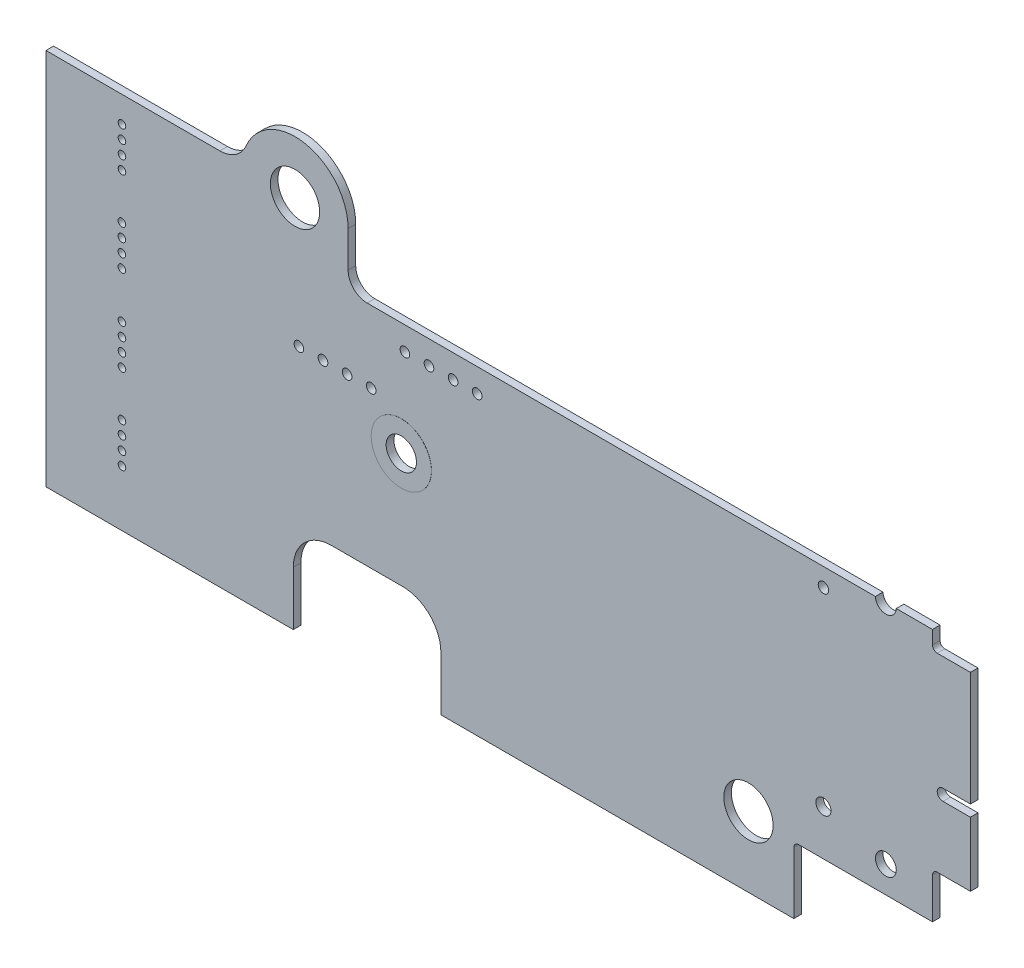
SolidWorks part; units mm, degrees
ref_plane "Front Plane" through (0, 0, 0) normal (0, 0, 1) x (1, 0, 0)
ref_plane "Top Plane" through (0, 0, 0) normal (0, 1, 0) x (1, 0, 0)
ref_plane "Right Plane" through (0, 0, 0) normal (1, 0, 0) x (0, 0, -1)
sketch "BOARD_GEOMETRY" plane through (0, 0, 0) normal (0, 0, 1) x (1, 0, 0)
  line L0 (0, 39.85) -> (0, 0)
  line L1 (0, 0) -> (26.08, 0)
  line L2 (26.08, 0) -> (26.08, 5.7)
  line L3 (30.08, 9.7) -> (37.64, 9.7)
  line L4 (41.64, 5.7) -> (41.64, 0)
  line L5 (41.64, 0) -> (78.86, 0)
  line L6 (78.86, 0) -> (78.86, 6.51)
  line L7 (79.36, 7.01) -> (93.48, 7.01)
  line L8 (93.48, 7.01) -> (93.48, 11.3)
  line L9 (93.98, 11.8) -> (97.48, 11.8)
  line L10 (97.48, 11.8) -> (97.48, 18.57)
  line L11 (97.48, 18.57) -> (94.58, 18.57)
  line L12 (94.58, 19.77) -> (97.48, 19.77)
  line L13 (97.48, 19.77) -> (97.48, 31.8)
  line L14 (97.48, 31.8) -> (93.98, 31.8)
  line L15 (93.48, 32.3) -> (93.48, 33.72)
  line L16 (93.48, 33.72) -> (89.66, 33.72)
  line L17 (87.46, 33.72) -> (33.86, 33.72)
  line L18 (31.86, 35.72) -> (31.86, 39.52)
  line L19 (18.33, 39.85) -> (0, 39.85)
  arc A0 (26.08, 5.7) -> (30.08, 9.7) centre (30.08, 5.7) cw
  arc A1 (37.64, 9.7) -> (41.64, 5.7) centre (37.64, 5.7) cw
  arc A2 (78.86, 6.51) -> (79.36, 7.01) centre (79.36, 6.51) cw
  arc A3 (93.48, 11.3) -> (93.98, 11.8) centre (93.98, 11.3) cw
  arc A4 (94.58, 18.57) -> (94.58, 19.77) centre (94.58, 19.17) cw
  arc A5 (93.98, 31.8) -> (93.48, 32.3) centre (93.98, 32.3) cw
  arc A6 (89.66, 33.72) -> (87.46, 33.72) centre (88.56, 33.76) cw
  arc A7 (33.86, 33.72) -> (31.86, 35.72) centre (33.86, 35.72) cw
  arc A8 (31.86, 39.52) -> (21.1, 41.69) centre (26.2611, 39.5198) ccw
  arc A9 (21.1, 41.69) -> (18.33, 39.85) centre (18.3323, 42.8515) cw
extrude "Board" add sketch "BOARD_GEOMETRY" along normal blind 0.8
ref_plane "BOTH" through (0, 0, 0.4) normal (0, 0, 1) x (1, 0, 0)
sketch "ROUTE_OUTLINE_ALL_ 0" plane through (0, 0, 0.4) normal (0, 0, 1) x (1, 0, 0)
  line L0 (96.88, 20.37) -> (96.88, 31.2)
  line L1 (96.88, 31.2) -> (93.98, 31.2)
  line L2 (92.88, 32.3) -> (92.88, 33.12)
  line L3 (92.88, 33.12) -> (90.1357, 33.12)
  line L4 (86.9843, 33.12) -> (33.86, 33.12)
  line L5 (31.26, 35.72) -> (31.26, 39.52)
  line L6 (18.3298, 39.25) -> (0.6, 39.25)
  line L7 (0.6, 39.25) -> (0.6, 0.6)
  line L8 (0.6, 0.6) -> (25.48, 0.6)
  line L9 (25.48, 0.6) -> (25.48, 5.7)
  line L10 (30.08, 10.3) -> (37.64, 10.3)
  line L11 (42.24, 5.7) -> (42.24, 0.6)
  line L12 (42.24, 0.6) -> (78.26, 0.6)
  line L13 (78.26, 0.6) -> (78.26, 6.51)
  line L14 (79.36, 7.61) -> (92.88, 7.61)
  line L15 (92.88, 7.61) -> (92.88, 11.3)
  line L16 (93.98, 12.4) -> (96.88, 12.4)
  line L17 (96.88, 12.4) -> (96.88, 17.97)
  line L18 (96.88, 17.97) -> (94.58, 17.97)
  line L19 (94.58, 20.37) -> (96.88, 20.37)
  arc A0 (93.98, 31.2) -> (92.88, 32.3) centre (93.98, 32.3) cw
  arc A1 (90.1357, 33.12) -> (86.9843, 33.12) centre (88.56, 33.76) cw
  arc A2 (33.86, 33.12) -> (31.26, 35.72) centre (33.86, 35.72) cw
  arc A3 (31.26, 39.52) -> (21.6532, 41.4576) centre (26.2611, 39.5198) ccw
  arc A4 (21.6532, 41.4576) -> (18.3298, 39.25) centre (18.3323, 42.8515) cw
  arc A5 (25.48, 5.7) -> (30.08, 10.3) centre (30.08, 5.7) cw
  arc A6 (37.64, 10.3) -> (42.24, 5.7) centre (37.64, 5.7) cw
  arc A7 (78.26, 6.51) -> (79.36, 7.61) centre (79.36, 6.51) cw
  arc A8 (92.88, 11.3) -> (93.98, 12.4) centre (93.98, 11.3) cw
  arc A9 (94.58, 17.97) -> (94.58, 20.37) centre (94.58, 19.17) cw
sketch "DRILLED_HOLES_PTH" plane through (0, 0, 0.8) normal (0, 0, 1) x (1, 0, 0)
  circle A0 centre (37.476, 21.793) radius 1.6
  circle A1 centre (8.011, 10.1094) radius 0.4
  circle A2 centre (8.011, 8.7094) radius 0.4
  circle A3 centre (8.011, 7.3094) radius 0.4
  circle A4 centre (8.011, 5.9094) radius 0.4
  circle A5 centre (8.001, 28.135) radius 0.4
  circle A6 centre (8.001, 26.735) radius 0.4
  circle A7 centre (8.001, 25.335) radius 0.4
  circle A8 centre (8.001, 23.935) radius 0.4
  circle A9 centre (8.011, 19.0924) radius 0.4
  circle A10 centre (8.011, 17.6924) radius 0.4
  circle A11 centre (8.011, 16.2924) radius 0.4
  circle A12 centre (8.011, 14.8924) radius 0.4
  circle A13 centre (8.011, 37.1094) radius 0.4
  circle A14 centre (8.011, 35.7094) radius 0.4
  circle A15 centre (8.011, 34.3094) radius 0.4
  circle A16 centre (8.011, 32.9094) radius 0.4
  circle A17 centre (26.67, 26.162) radius 0.508
  circle A18 centre (29.21, 26.162) radius 0.508
  circle A19 centre (31.75, 26.162) radius 0.508
  circle A20 centre (34.29, 26.162) radius 0.508
  circle A21 centre (40.386, 31.242) radius 0.508
  circle A22 centre (42.926, 31.242) radius 0.508
  circle A23 centre (45.466, 31.242) radius 0.508
  circle A24 centre (37.846, 31.242) radius 0.508
extrude "Plated_Drill_Holes" cut sketch "DRILLED_HOLES_PTH" against normal blind 0.8
sketch "DRILLED_HOLES_NPTH" plane through (0, 0, 0.8) normal (0, 0, 1) x (1, 0, 0)
  circle A0 centre (74.074, 7.405) radius 2.6
  circle A1 centre (26.259, 39.52) radius 2.6
  circle A2 centre (88.562, 9.831) radius 1.1
  circle A3 centre (81.981, 31.793) radius 0.55
  circle A4 centre (81.981, 11.793) radius 0.8
extrude "Non_Plated_Drill_Holes" cut sketch "DRILLED_HOLES_NPTH" against normal through all
sketch "PlaceKeepout_BOTTOM__0" plane through (0, 0, 0) normal (0, 0, 1) x (1, 0, 0)
  line L0 (11.176, 12.7) -> (14.351, 12.7)
  line L1 (14.351, 12.7) -> (14.351, 37.592)
  line L2 (14.351, 37.592) -> (11.176, 37.592)
  line L3 (11.176, 37.592) -> (11.176, 12.7)
sketch "PlaceKeepout_BOTTOM_2_1" plane through (0, 0, 0) normal (0, 0, 1) x (1, 0, 0)
  line L0 (30.3732, 32.4652) -> (30.3732, 21.3739)
  line L1 (30.3732, 21.3739) -> (47.4627, 11.1512)
  line L2 (47.4627, 11.1512) -> (83.4986, 11.1512)
  line L3 (83.4986, 11.1512) -> (83.4986, 32.4652)
  line L4 (83.4986, 32.4652) -> (30.3732, 32.4652)
sketch "PlaceKeepout_TOP_5_2" plane through (0, 0, 0.8) normal (0, 0, 1) x (1, 0, 0)
  line L0 (22.3852, 48.2184) -> (22.3852, 0.5232)
  line L1 (22.3852, 0.5232) -> (30.67, 0.56)
  line L2 (30.67, 0.56) -> (30.43, 4.79)
  line L3 (30.43, 4.79) -> (41.6367, 4.8066)
  line L4 (41.6367, 4.8066) -> (66.1864, 4.8066)
  line L5 (66.1864, 4.8066) -> (66.1864, 0.5)
  line L6 (66.1864, 0.5) -> (78.86, 0)
  line L7 (78.86, 0) -> (78.86, 7.01)
  line L8 (78.86, 7.01) -> (93.48, 7.01)
  line L9 (93.48, 7.01) -> (93.4762, 33.7184)
  line L10 (93.4762, 33.7184) -> (37.67, 36.99)
  line L11 (37.67, 36.99) -> (33.49, 48.22)
  line L12 (33.49, 48.22) -> (22.3852, 48.2184)
sketch "PlaceKeepout_TOP_8_3" plane through (0, 0, 0.8) normal (0, 0, 1) x (1, 0, 0)
  line L0 (6.4204, 0.5232) -> (11.7, 0.5232)
  line L1 (11.7, 0.5232) -> (11.7, 3.5232)
  line L2 (11.7, 3.5232) -> (6.4204, 3.5232)
  line L3 (6.4204, 3.5232) -> (6.4204, 0.5232)
sketch "PlaceKeepout_TOP_3_4" plane through (0, 0, 0.8) normal (0, 0, 1) x (1, 0, 0)
  line L0 (0, 42.0848) -> (22.3852, 42.0848)
  line L1 (22.3852, 42.0848) -> (22.3852, 48.22)
  line L2 (22.3852, 48.22) -> (0, 48.22)
  line L3 (0, 48.22) -> (0, 42.0848)
sketch "PlaceKeepout_TOP_3_5" plane through (0, 0, 0.8) normal (0, 0, 1) x (1, 0, 0)
  line L0 (42.14, 0.5) -> (66.1864, 0.5)
  line L1 (66.1864, 0.5) -> (66.1864, 4.8066)
  line L2 (66.1864, 4.8066) -> (42.14, 4.8066)
  line L3 (42.14, 4.8066) -> (42.14, 0.5)
sketch "Sketch13" plane through (0, 0, 0.8) normal (0, 0, 1) x (1, 0, 0)
  circle A0 centre (37.476, 21.793) radius 3.175
  circle A1 centre (37.476, 21.793) radius 1.6 construction
  circle A2 centre (37.476, 21.793) radius 1.6
  dimension "D1" = 6.35
extrude "Boss-Extrude2" add sketch "Sketch13" along normal blind 0.01
sketch "Sketch14" plane through (0, 0, 0) normal (0, 0, -1) x (-1, 0, 0)
  circle A0 centre (-37.476, 21.793) radius 3.175
  circle A1 centre (-37.476, 21.793) radius 1.6 construction
  circle A2 centre (-37.476, 21.793) radius 1.6
  dimension "D1" = 6.35
extrude "Boss-Extrude3" add sketch "Sketch14" along normal blind 0.01
